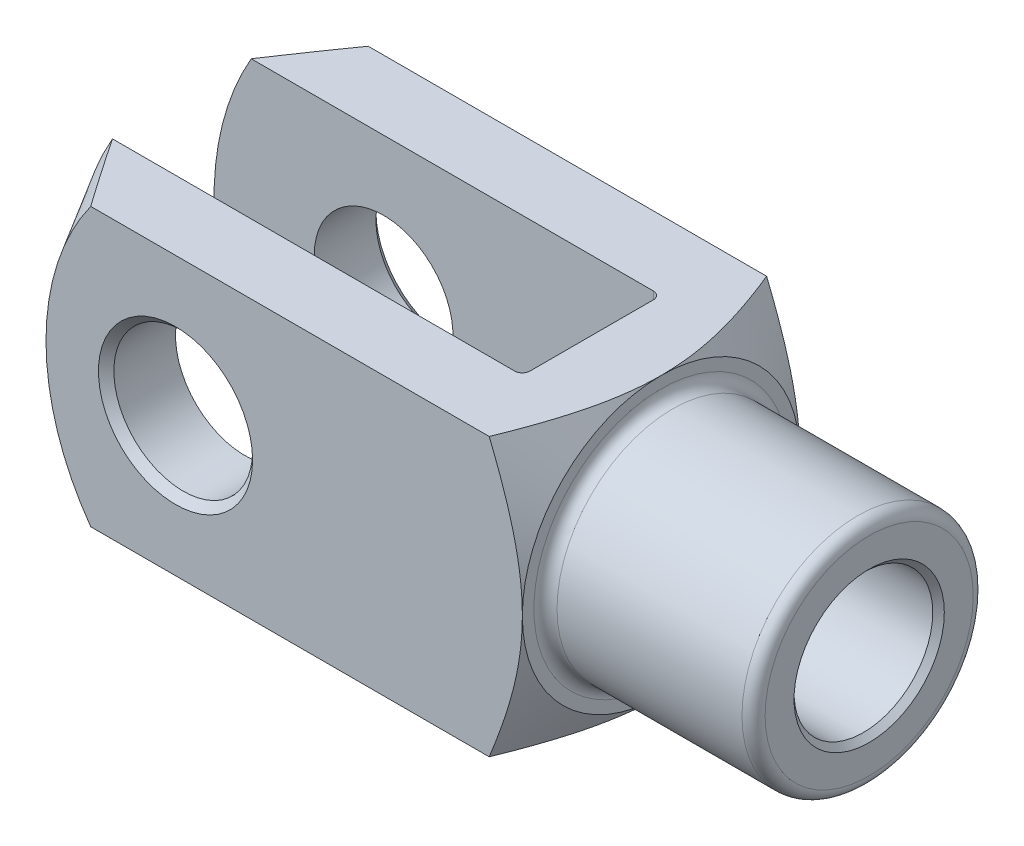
SolidWorks part; units mm, degrees
ref_plane "Front Plane" through (0, 0, 0) normal (0, 0, 1) x (1, 0, 0)
ref_plane "Top Plane" through (0, 0, 0) normal (0, 1, 0) x (1, 0, 0)
ref_plane "Right Plane" through (0, 0, 0) normal (1, 0, 0) x (0, 0, -1)
sketch "Sketch1" plane through (0, 0, 0) normal (1, 0, 0) x (0, 0, -1)
  line L0 (0, 0) -> (0, 50000) construction
  line L1 (0, 0) -> (50000, 0) construction
  line L2 (-18, -18) -> (-18, 18)
  line L3 (-18, 18) -> (18, 18)
  line L4 (18, -18) -> (18, 18)
  line L5 (-18, -18) -> (18, -18)
  point P9 (0, 18)
  point P11 (18, 0)
  point P12 (-18, 0)
  dimension "D1" = 36
  dimension "D2" = 36
extrude "Extrude1" add sketch "Sketch1" against normal blind 94
sketch "Sketch2" plane through (0, 0, 0) normal (1, 0, 0) x (0, 0, -1)
  circle A0 centre (0, 0) radius 15
  circle A1 centre (0, 0) radius 30
  dimension "D1" = 30
  dimension "D2" = 60
extrude "Extrude2" cut sketch "Sketch2" against normal blind 27
sketch "Sketch3" plane through (0, 0, 18) normal (0, 0, 1) x (1, 0, 0)
  circle A0 centre (-72, 0) radius 9
  dimension "D1" = 18
  dimension "D2" = 72
extrude "Extrude3" cut sketch "Sketch3" against normal through all
sketch "Sketch4" plane through (0, 18, 0) normal (0, 1, 0) x (1, 0, 0)
  line L0 (0, 0) -> (-50000, 0) construction
  line L1 (-94, -9) -> (-94, 9)
  line L2 (-94, 18) -> (-94, -18) construction
  line L3 (-94, 9) -> (-36, 9)
  line L4 (-36, 9) -> (-36, -9)
  line L5 (-72, 18) -> (-72, -18) construction
  line L6 (-94, -9) -> (-36, -9)
  point P7 (-72, 0)
  point P13 (-36, 0)
  point P14 (-94, 0)
  dimension "D1" = 36
  dimension "D2" = 18
extrude "Extrude4" cut sketch "Sketch4" against normal through all
fillet "Fillet1" radius 1 2 edges at (-36, 0, 9) (-36, 0, -9)
fillet "Fillet2" radius 1.5 2 edges at (0, 0, -15) (-27, 0, -15)
chamfer "Chamfer2" distance 1 angle 45 2 edges at (-63, 0, -18) (-63, 0, 18)
sketch "Sketch6" plane through (0, 0, 0) normal (0, 0, 1) x (1, 0, 0)
  line L0 (-27, -18) -> (-27, -36)
  line L1 (-27, -36) -> (-37.3923, -36)
  line L2 (-37.3923, -36) -> (-27, -18)
  dimension "D1" = 30
  dimension "D2" = 36
revolve "Cut-Revolve1" cut sketch "Sketch6" angle 360 about axis through (-27, 0, 0) along (1, 0, 0)
sketch "Sketch7" plane through (0, 0, 0) normal (0, 1, 0) x (1, 0, 0)
  line L0 (-88.8038, -18) -> (-94, -9)
  line L1 (-94, 9) -> (-88.8038, 18)
  line L2 (-88.8038, 18) -> (-130, 18)
  line L3 (-94, 9) -> (-94, -9)
  line L4 (-130, 18) -> (-130, -18)
  line L5 (-130, -18) -> (-88.8038, -18)
  line L6 (-94, 18) -> (-31.3046, 18) construction
  line L7 (-94, -18) -> (-31.3046, -18) construction
  line L8 (-58, 0.6162) -> (-58, 50000.6162) construction
  dimension "D1" = 120
  dimension "D2" = 36
  dimension "D3" = 36
revolve "Cut-Revolve2" cut sketch "Sketch7" angle 180 about L8
sketch "Sketch8" plane through (0, 0, 0) normal (1, 0, 0) x (0, 0, -1)
  circle A0 centre (0, 0) radius 9
  dimension "D1" = 18
extrude "Extrude5" cut sketch "Sketch8" against normal through all
chamfer "Chamfer3" distance 0.75 angle 45 1 edges at (0, 0, -9)
equation "\"D2@Sketch1\" = \"D1@Sketch1\""
equation "\"D2@Sketch2\" = \"D1@Sketch2\"*2"
equation "\"D2@Sketch6\" = \"D1@Sketch1\""
equation "\"D2@Sketch7\" = \"D1@Sketch1\""
equation "\"D3@Sketch7\" = \"D1@Sketch1\""
